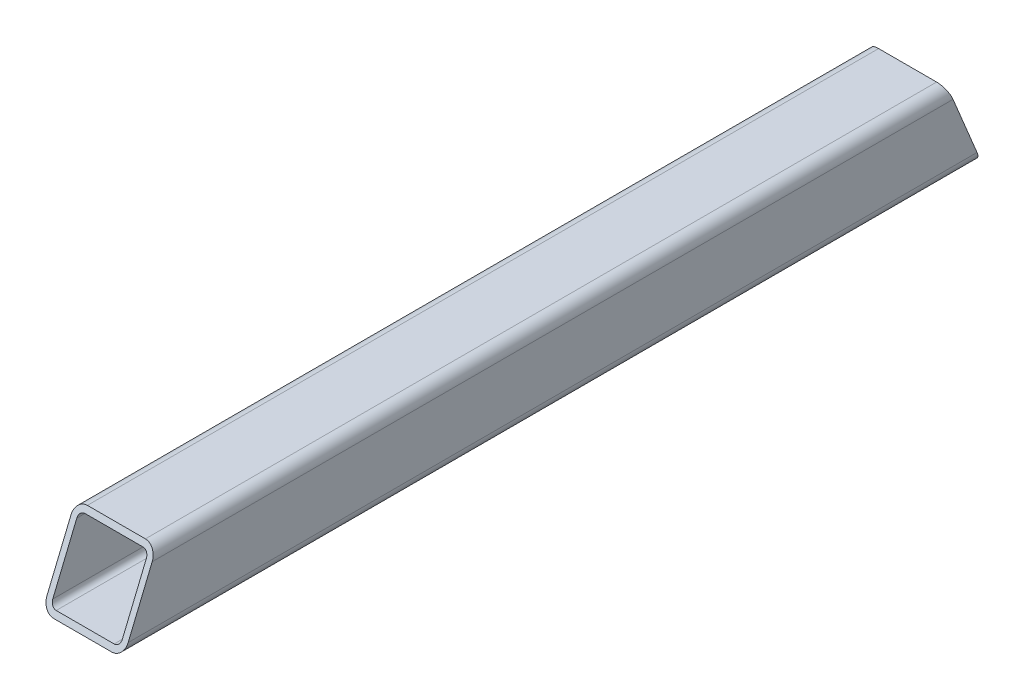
SolidWorks part; units mm, degrees
ref_plane "Plan de face" through (0, 0, 0) normal (0, 0, 1) x (1, 0, 0)
ref_plane "Plan de dessus" through (0, 0, 0) normal (0, 1, 0) x (1, 0, 0)
ref_plane "Plan de droite" through (0, 0, 0) normal (1, 0, 0) x (0, 0, -1)
sketch "Esquisse1" plane through (0, 0, 0) normal (0, 0, 1) x (1, 0, 0)
  line L0 (-25, 30) -> (25, 30)
  line L1 (-25, 35) -> (25, 35)
  line L2 (-35, 25) -> (-35, -25)
  line L3 (-25, -35) -> (25, -35)
  line L4 (35, 25) -> (35, -25)
  line L5 (30, 25) -> (30, -25)
  line L6 (-25, -30) -> (25, -30)
  line L7 (-30, 25) -> (-30, -25)
  arc A0 (-25, -35) -> (-35, -25) centre (-25, -25) cw
  arc A1 (35, 25) -> (25, 35) centre (25, 25) ccw
  arc A2 (-25, 35) -> (-35, 25) centre (-25, 25) ccw
  arc A3 (35, -25) -> (25, -35) centre (25, -25) cw
  arc A4 (30, 25) -> (25, 30) centre (25, 25) ccw
  arc A5 (30, -25) -> (25, -30) centre (25, -25) cw
  arc A6 (-25, -30) -> (-30, -25) centre (-25, -25) cw
  arc A7 (-25, 30) -> (-30, 25) centre (-25, 25) ccw
  point P4 (35, 0)
  point P5 (0, 35)
  dimension "D1" = 10
  dimension "D2" = 10
  dimension "D3" = 70
  dimension "D4" = 70
  dimension "D5" = 5
extrude "Boss.-Extru.1" add sketch "Esquisse1" along normal mid plane 740
sketch "Esquisse2" plane through (35, 0, 0) normal (1, 0, 0) x (0, 0, -1)
  line L0 (370, -35) -> (322.6943, 79.2059)
  line L1 (370, -25) -> (370, 25) construction
  line L2 (370, -35) -> (370, 45.5484)
  dimension "D1" = 22.5
extrude "Enlèv. mat.-Extru.1" cut sketch "Esquisse2" against normal through all and the other way through all
mirror "Symétrie1" about plane through (0, 0, 0) normal (0, 0, 1) of "Enlèv. mat.-Extru.1"
